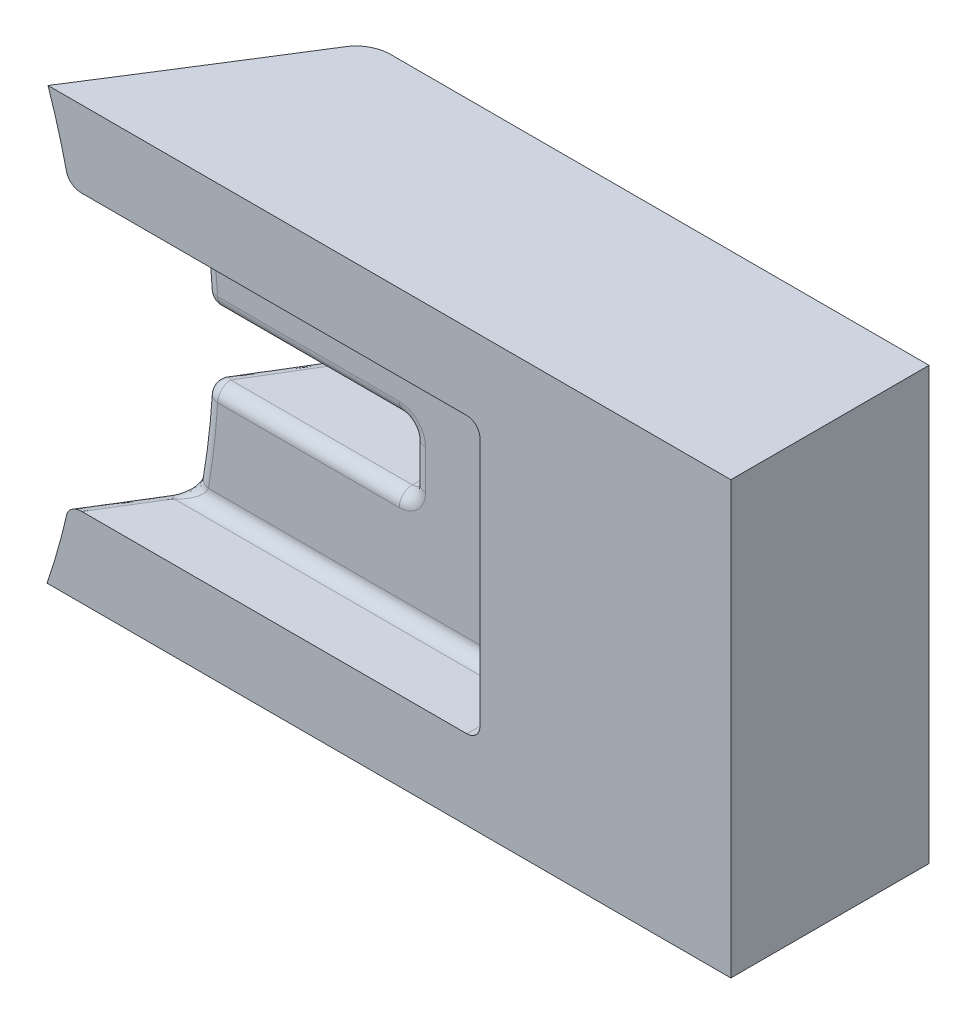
SolidWorks part; units mm, degrees
ref_plane "Plan de face" through (0, 0, 0) normal (0, 0, 1) x (1, 0, 0)
ref_plane "Plan de dessus" through (0, 0, 0) normal (0, 1, 0) x (1, 0, 0)
ref_plane "Plan de droite" through (0, 0, 0) normal (1, 0, 0) x (0, 0, -1)
sketch "Esquisse1" plane through (0, 0, 0) normal (0, 0, 1) x (1, 0, 0)
  line L1 (91.6738, 32.6431) -> (200.2326, 32.6431)
  line L2 (91.6738, 32.6431) -> (91.6738, -33.1148)
  line L3 (91.6738, -33.1148) -> (200.2326, -33.1148)
  line L4 (200.2326, 32.6431) -> (200.2326, -33.1148)
extrude "Boss.-Extru.1" add sketch "Esquisse1" along normal blind 30.2 contours L3 L4 L1 L2
other "Empreinte1"
other "Couvercle bogie TGV v2<1>@Assemblage11"
